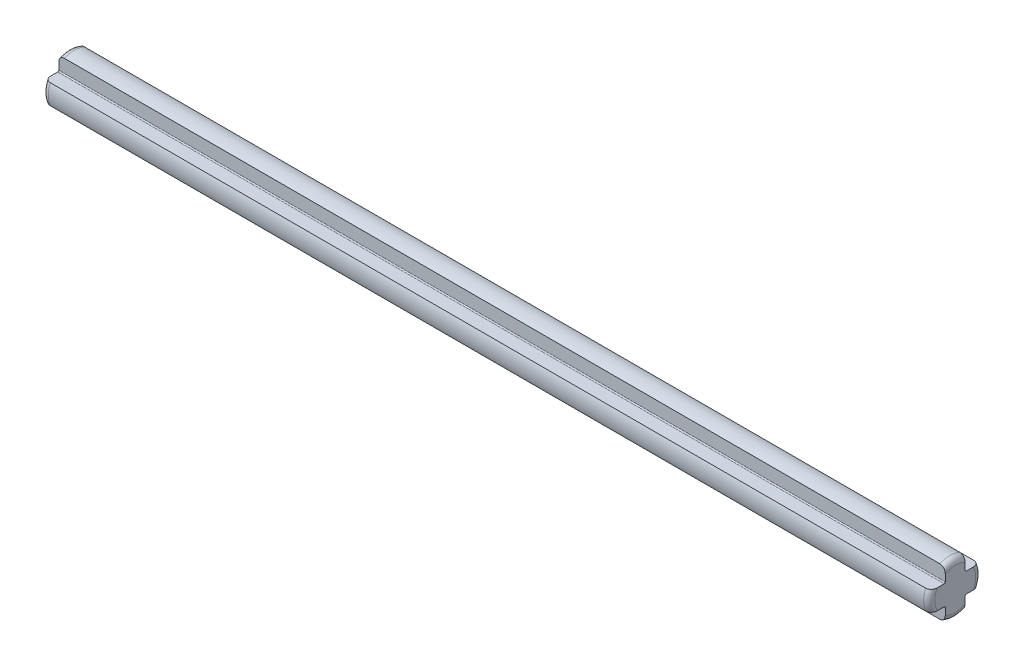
SolidWorks part; units mm, degrees
ref_plane "Alzado" through (0, 0, 0) normal (0, 0, 1) x (1, 0, 0)
ref_plane "Planta" through (0, 0, 0) normal (0, 1, 0) x (1, 0, 0)
ref_plane "Vista lateral" through (0, 0, 0) normal (1, 0, 0) x (0, 0, -1)
sketch "Croquis1" plane through (0, 0, 0) normal (1, 0, 0) x (0, 0, -1)
  line L0 (-3.7919, 0) -> (3.9132, 0) construction
  line L1 (-0.9, 2.1708) -> (-0.9, 1)
  line L2 (-2.1708, 0.9) -> (-1, 0.9)
  line L3 (2.1708, 0.9) -> (1, 0.9)
  line L4 (0.9, 2.1708) -> (0.9, 1)
  line L5 (0, 3.4809) -> (0, -0.8787) construction
  line L6 (0.9, -2.1708) -> (0.9, -1)
  line L7 (2.1708, -0.9) -> (1, -0.9)
  line L8 (-2.1708, -0.9) -> (-1, -0.9)
  line L9 (-0.9, -2.1708) -> (-0.9, -1)
  arc A0 (-2.1708, 0.9) -> (-2.1708, -0.9) centre (0, 0) ccw
  arc A1 (0.9, 2.1708) -> (-0.9, 2.1708) centre (0, 0) ccw
  arc A2 (-1, 0.9) -> (-0.9, 1) centre (-1, 1) ccw
  arc A3 (1, 0.9) -> (0.9, 1) centre (1, 1) cw
  arc A4 (2.1708, 0.9) -> (2.1708, -0.9) centre (0, 0) cw
  arc A5 (1, -0.9) -> (0.9, -1) centre (1, -1) ccw
  arc A6 (-1, -0.9) -> (-0.9, -1) centre (-1, -1) cw
  arc A7 (0.9, -2.1708) -> (-0.9, -2.1708) centre (0, 0) cw
  dimension "D1" = 2.35
  dimension "D4" = 0.1
  dimension "D2" = 1.8
  dimension "D3" = 1.8
extrude "Extruir1" add sketch "Croquis1" along normal mid plane 80
fillet "Redondeo1" radius 0.5 8 edges at (40, 2.35, 0) (40, 0, -2.35) (40, -2.35, 0) (40, 0, 2.35) (-40, -2.35, 0) (-40, 0, -2.35) (-40, 2.35, 0) (-40, 0, 2.35)
